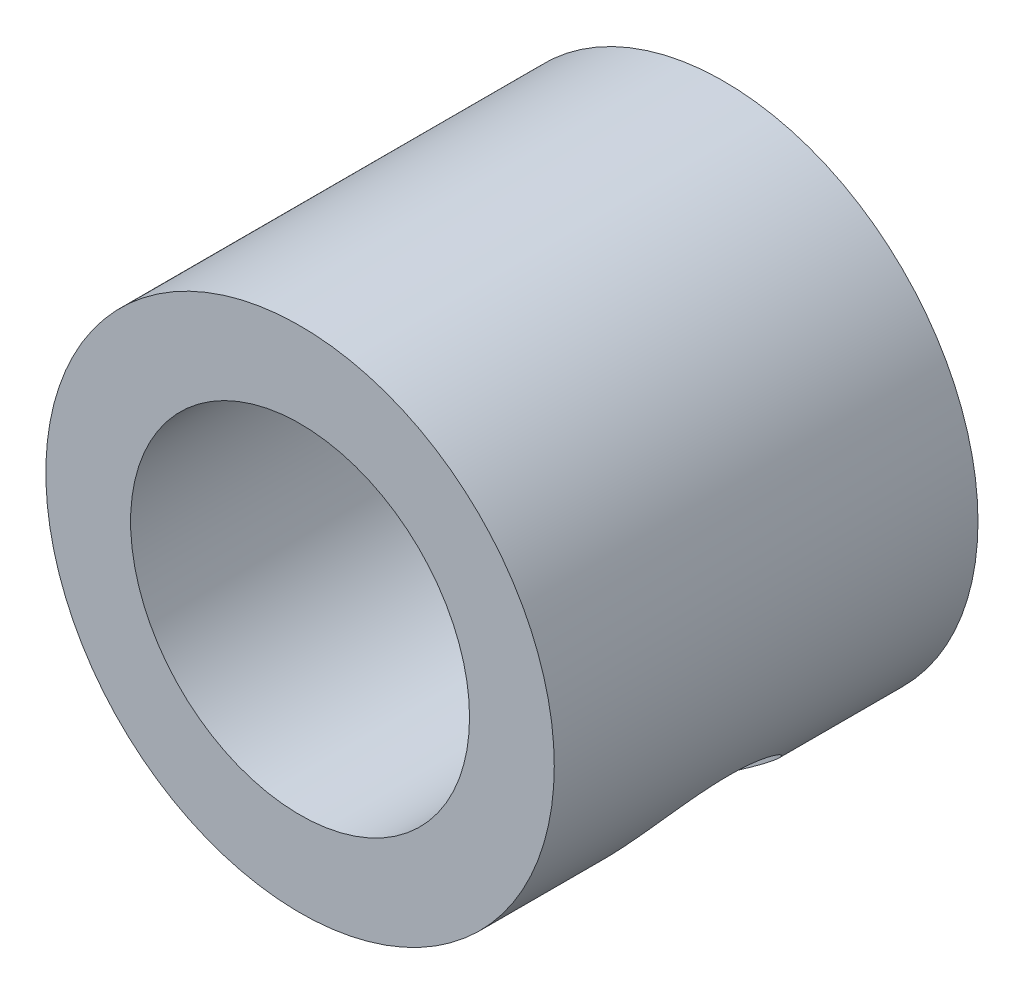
SolidWorks part; units mm, degrees
ref_plane "Front Plane" through (0, 0, 0) normal (0, 0, 1) x (1, 0, 0)
ref_plane "Top Plane" through (0, 0, 0) normal (0, 1, 0) x (1, 0, 0)
ref_plane "Right Plane" through (0, 0, 0) normal (1, 0, 0) x (0, 0, -1)
sketch "Sketch1" plane through (0, 0, 0) normal (0, 0, 1) x (1, 0, 0)
  circle A0 centre (0, 0) radius 2
  circle A1 centre (0, 0) radius 3
  dimension "D1" = 4
  dimension "D2" = 6
extrude "Extrude1" add sketch "Sketch1" along normal blind 5
hole_wizard "#4-40 Tapped Hole1" positions "3DSketch1" profile "Sketch2" tap size "#4-40" standard "Ansi Inch"
sketch3d "3DSketch1"
  point P0 (1.187, -1.6097, 2.5)
  dimension "D1" = 2.5
sketch "Sketch2" plane through (1.187, -1.6097, 2.5) normal (0, 0, 1) x (-0.8048, -0.5935, 0)
  line L0 (0, 0) -> (0, 8.2792)
  line L1 (0, 8.2792) -> (1.1303, 7.6)
  line L2 (1.1303, 7.6) -> (1.1303, 0)
  line L5 (1.1303, 0) -> (0, 0)
  line L10 (0, 8.2792) -> (-1.1303, 7.6) construction
  line L11 (0, -6.35) -> (0, 107.95) construction
  dimension "Tap Drill Dia." = 2.2606
  dimension "Tap Drill Depth" = 7.6
  dimension "Drill Angle" = 118
